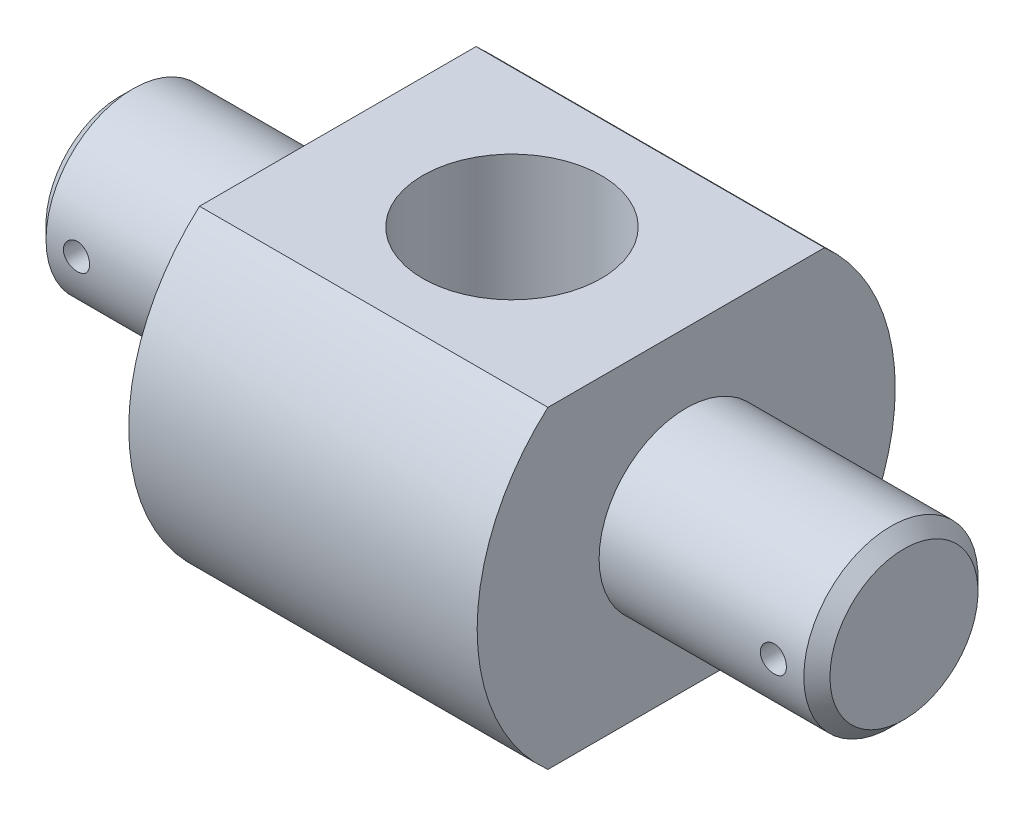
SolidWorks part; units mm, degrees
ref_plane "Plan de face" through (0, 0, 0) normal (0, 0, 1) x (1, 0, 0)
ref_plane "Plan de dessus" through (0, 0, 0) normal (0, 1, 0) x (1, 0, 0)
ref_plane "Plan de droite" through (0, 0, 0) normal (1, 0, 0) x (0, 0, -1)
sketch "Esquisse1" plane through (0, 0, 0) normal (0, 0, 1) x (1, 0, 0)
  line L0 (0, 0) -> (98.5046, 0) construction
  line L1 (0, 0) -> (0, 10)
  line L2 (0, 10) -> (25, 10)
  line L3 (25, 10) -> (25, 24)
  line L4 (25, 24) -> (65, 24)
  line L5 (65, 24) -> (65, 10)
  line L6 (65, 10) -> (90, 10)
  line L7 (90, 10) -> (90, 0)
  line L8 (90, 0) -> (0, 0)
  dimension "D1" = 24
  dimension "D2" = 10
  dimension "D3" = 90
  dimension "D4" = 25
  dimension "D5" = 25
revolve "Révolution1" add sketch "Esquisse1" angle 360 about L0
chamfer "Chanfrein1" distance 1.5 angle 45 2 edges at (90, 0, 10) (0, 0, 10)
sketch "Esquisse2" plane through (0, 0, 0) normal (0, 0, 1) x (1, 0, 0)
  line L0 (0, 0) -> (98.5046, 0) construction
  line L1 (74.4383, 18) -> (14.659, 18)
  line L2 (74.4383, 18) -> (74.4383, 38.5617)
  line L3 (74.4383, 38.5617) -> (14.659, 38.5617)
  line L4 (14.659, 18) -> (14.659, 38.5617)
  line L5 (14.659, -34.1484) -> (74.4383, -34.1484)
  line L6 (14.659, -34.1484) -> (14.659, -18)
  line L7 (14.659, -18) -> (74.4383, -18)
  line L8 (74.4383, -34.1484) -> (74.4383, -18)
  dimension "D1" = 18
  dimension "D2" = 18
extrude "Enlèv. mat.-Extru.1" cut sketch "Esquisse2" against normal through all and the other way through all
sketch "Esquisse3" plane through (0, 18, 0) normal (0, 1, 0) x (-1, 0, 0)
  line L0 (0, 0) -> (-98.5046, 0) construction
  line L1 (-65, -15.8745) -> (-65, 15.8745) construction
  circle A0 centre (-45, 0) radius 10.25
  dimension "D1" = 20.5
  dimension "D2" = 20
extrude "Enlèv. mat.-Extru.2" cut sketch "Esquisse3" against normal through all
sketch "Esquisse4" plane through (0, 0, 0) normal (0, 0, 1) x (1, 0, 0)
  line L0 (0, 0) -> (98.5046, 0) construction
  line L1 (0, 8.5) -> (0, -8.5) construction
  circle A0 centre (5, 0) radius 1.5
  circle A1 centre (85, 0) radius 1.5
  dimension "D1" = 3
  dimension "D2" = 3
  dimension "D3" = 80
  dimension "D4" = 5
extrude "Enlèv. mat.-Extru.3" cut sketch "Esquisse4" against normal through all and the other way through all
